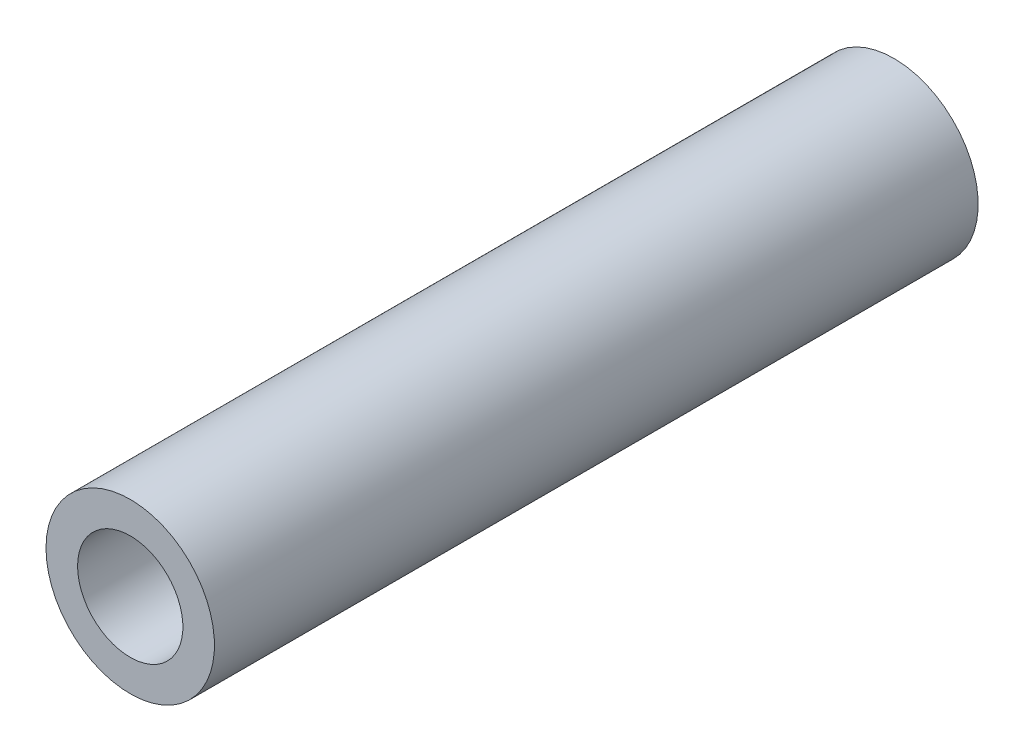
SolidWorks part; units mm, degrees
ref_plane "Plan1" through (0, 0, 0) normal (0, 0, 1) x (1, 0, 0)
ref_plane "Plan2" through (0, 0, 0) normal (0, 1, 0) x (1, 0, 0)
ref_plane "Plan3" through (0, 0, 0) normal (1, 0, 0) x (0, 0, -1)
sketch "Esquisse3" plane through (0, 0, 0) normal (0, 0, 1) x (1, 0, 0)
  circle A0 centre (0, 0) radius 4
  circle A1 centre (0, 0) radius 2.5
  dimension "D1" = 8
  dimension "D2" = 5
extrude "Base-Extrusion" add sketch "Esquisse3" along normal blind 36.27
